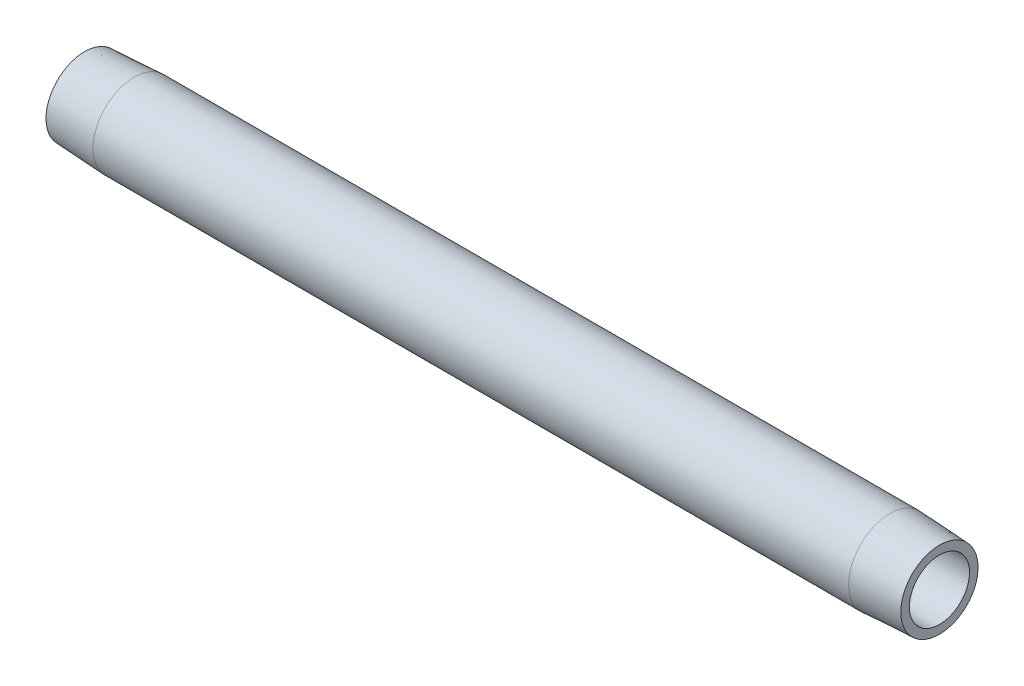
SolidWorks part; units mm, degrees
ref_plane "Front Plane" through (0, 0, 0) normal (0, 0, 1) x (1, 0, 0)
ref_plane "Top Plane" through (0, 0, 0) normal (0, 1, 0) x (1, 0, 0)
ref_plane "Right Plane" through (0, 0, 0) normal (1, 0, 0) x (0, 0, -1)
sketch "Sketch1" plane through (0, 0, 0) normal (0, 0, 1) x (1, 0, 0)
  line L5 (177.8, 6.2611) -> (0, 6.2611)
  line L6 (167.4876, 8.5725) -> (10.3124, 8.5725)
  line L7 (10.3124, 8.5725) -> (0, 8.0321)
  line L8 (177.8, 8.0321) -> (167.4876, 8.5725)
  line L9 (177.8, 6.2611) -> (177.8, 8.0321)
  line L10 (0, 6.2611) -> (0, 8.0321)
  line L11 (0, 0) -> (50000, 0) construction
  line L12 (0, -55) -> (0, 55) construction
  dimension "D1" = 12.5222
  dimension "D2" = 17.145
  dimension "D3" = 3
  dimension "D4" = 3
  dimension "D5" = 177.8
  dimension "D6" = 10.3124
  dimension "D7" = 10.3124
revolve "Revolve1" add sketch "Sketch1" angle 360 about L11
